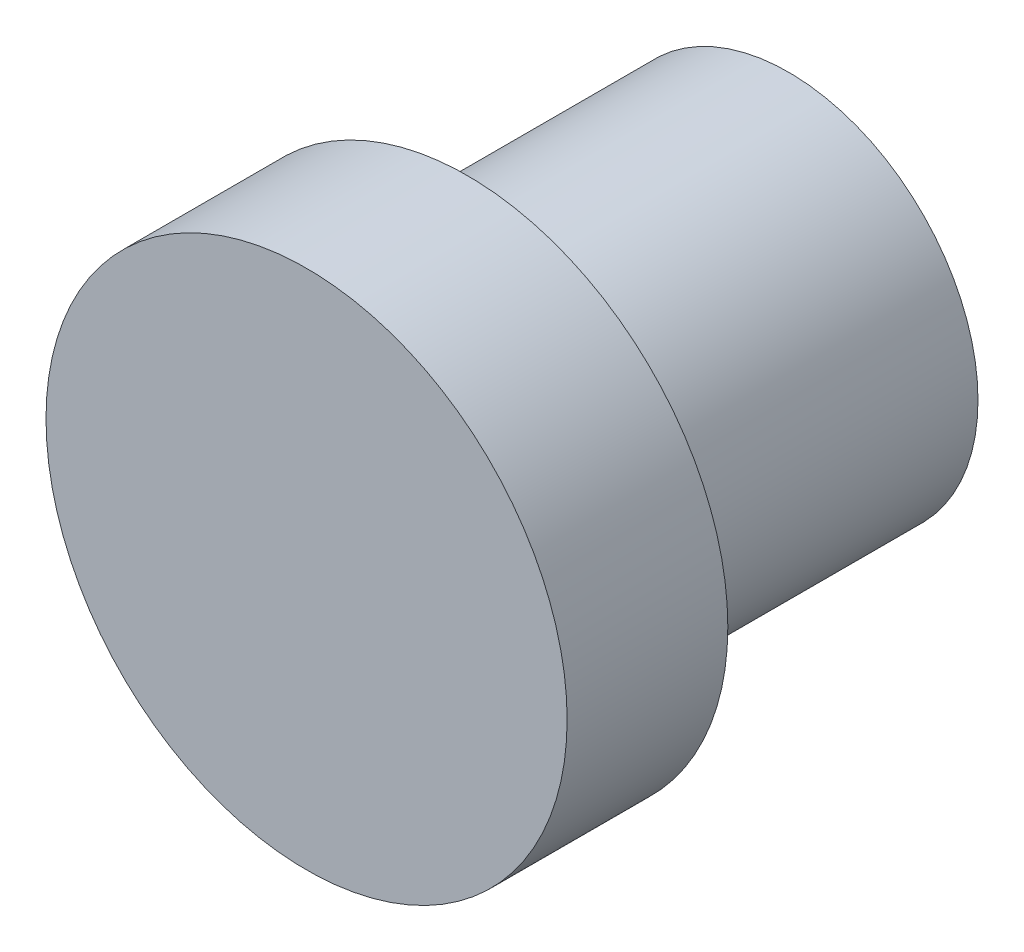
SolidWorks part; units mm, degrees
ref_plane "Front Plane" through (0, 0, 0) normal (0, 0, 1) x (1, 0, 0)
ref_plane "Top Plane" through (0, 0, 0) normal (0, 1, 0) x (1, 0, 0)
ref_plane "Right Plane" through (0, 0, 0) normal (1, 0, 0) x (0, 0, -1)
sketch "Sketch1" plane through (0, 0, 0) normal (0, 0, 1) x (1, 0, 0)
  circle A0 centre (0, 0) radius 2.9925
extrude "Boss-Extrude1" add sketch "Sketch1" against normal blind 5.08
sketch "Sketch2" plane through (0, 0, 0) normal (0, 0, 1) x (1, 0, 0)
  circle A0 centre (0, 0) radius 4.1185
extrude "Boss-Extrude2" add sketch "Sketch2" along normal blind 2.54
